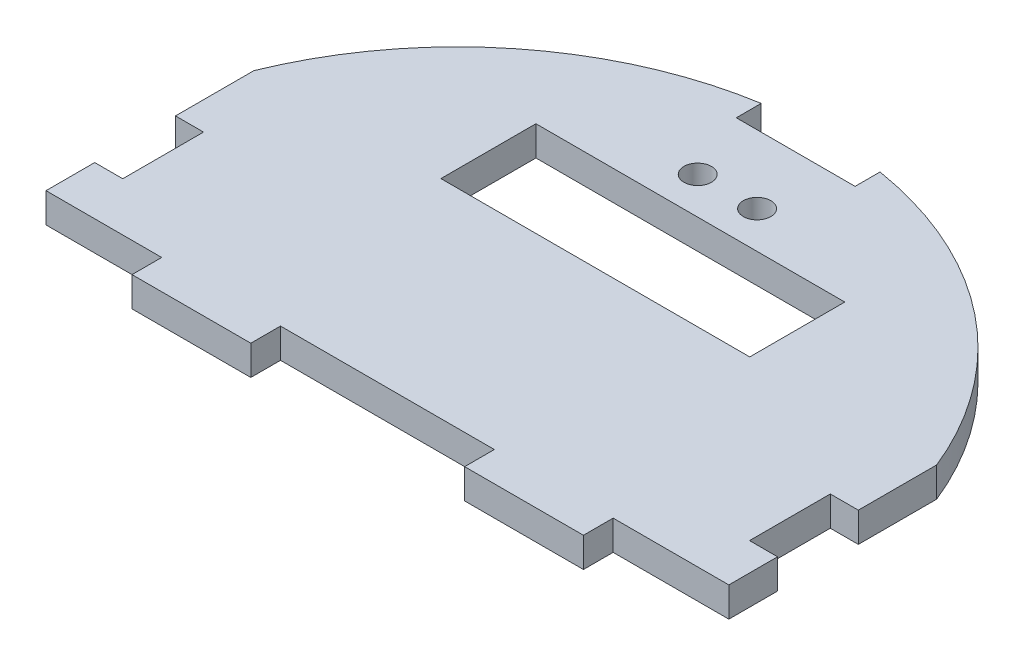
SolidWorks part; units mm, degrees
ref_plane "Front Plane" through (0, 0, 0) normal (0, 0, 1) x (1, 0, 0)
ref_plane "Top Plane" through (0, 0, 0) normal (0, 1, 0) x (1, 0, 0)
ref_plane "Right Plane" through (0, 0, 0) normal (1, 0, 0) x (0, 0, -1)
sketch "Sketch1" plane through (0, 0, 0) normal (0, 1, 0) x (1, 0, 0)
  line L0 (0, -15) -> (0, 35) construction
  line L1 (-24.13, -15) -> (-11.43, -15)
  line L2 (-36.5, 2.018) -> (-36.5, 10.4)
  line L3 (-36.5, 10.4) -> (-16.51, 10.4) construction
  line L4 (-36.5, -6.618) -> (-36.5, -11.825)
  line L5 (16.51, 10.4) -> (36.5, 10.4) construction
  line L6 (0, 31.821) -> (-6.35, 31.821)
  line L7 (-6.35, 34.4846) -> (-6.35, 31.821)
  line L8 (0, 31.821) -> (6.35, 31.821)
  line L9 (6.35, 34.4846) -> (6.35, 31.821)
  line L10 (-16.51, 20.56) -> (16.51, 20.56)
  line L11 (-16.51, 20.56) -> (-16.51, 10.4)
  line L12 (-16.51, 10.4) -> (16.51, 10.4)
  line L13 (16.51, 20.56) -> (16.51, 10.4)
  line L14 (-33.5028, -6.618) -> (-33.5028, 2.018)
  line L15 (36.5, 10.4) -> (36.5, 2.018)
  line L16 (36.5, 2.018) -> (33.5028, 2.018)
  line L17 (11.43, -15) -> (24.13, -15)
  line L18 (33.5028, -11.825) -> (36.5, -11.825)
  line L19 (36.5, -6.618) -> (33.5028, -6.618)
  line L20 (36.5, -6.618) -> (36.5, -11.825)
  line L24 (-36.5, -6.618) -> (-33.5028, -6.618)
  line L25 (-33.5028, -11.825) -> (-36.5, -11.825)
  line L27 (-36.5, 2.018) -> (-33.5028, 2.018)
  line L30 (-24.13, -15) -> (-24.13, -11.825)
  line L31 (-11.43, -11.825) -> (-11.43, -15)
  line L32 (-24.13, -11.825) -> (-33.5028, -11.825)
  line L33 (24.13, -11.825) -> (33.5028, -11.825)
  line L34 (11.43, -11.825) -> (11.43, -15)
  line L35 (24.13, -15) -> (24.13, -11.825)
  line L36 (-11.43, -11.825) -> (11.43, -11.825)
  line L37 (33.5028, -6.618) -> (33.5028, 2.018)
  arc A0 (6.35, 34.4846) -> (36.5, 10.4) centre (0, -4.3783) cw
  circle A1 centre (-3.175, 24.5204) radius 1.4732
  circle A2 centre (3.175, 24.5204) radius 1.4732
  arc A3 (-36.5, 10.4) -> (-6.35, 34.4846) centre (0, -4.3783) cw
  point P0 (0, 0)
  dimension "D3" = 50
  dimension "D4" = 12.7
  dimension "D5" = 12.7
  dimension "D6" = 33.02
  dimension "D7" = 10.16
  dimension "D9" = 3.175
extrude "Extrude1" add sketch "Sketch1" along normal blind 3.175 contours A3 L2 L27 L14 L24 L4 L25 L32 L30 L1 L31 L36 L34 L17 L35 L33 L18 L20 L19 L37 L16 L15 A0 L9 L8 L6 L7 L10 L13 L12 L11 A1 A2
